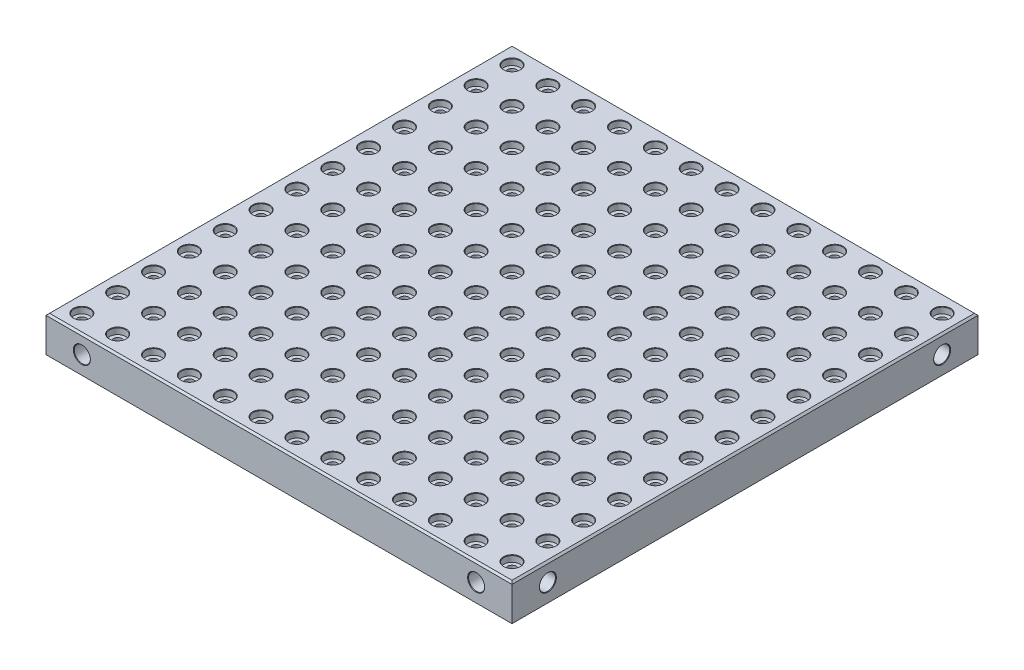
SolidWorks part; units mm, degrees
ref_plane "Plan1" through (0, 0, 0) normal (0, 0, 1) x (1, 0, 0)
ref_plane "Plan2" through (0, 0, 0) normal (0, 1, 0) x (1, 0, 0)
ref_plane "Plan3" through (0, 0, 0) normal (1, 0, 0) x (0, 0, -1)
sketch "Esquisse1" plane through (0, 0, 0) normal (0, 1, 0) x (1, 0, 0)
  line L1 (-260, -260) -> (260, -260)
  line L2 (-260, -260) -> (-260, 260)
  line L3 (-260, 260) -> (260, 260)
  line L4 (260, -260) -> (260, 260)
  dimension "D1" = 520
  dimension "D2" = 520
  dimension "D3" = 260
  dimension "D4" = 260
extrude "Base-Extrusion" add sketch "Esquisse1" along normal blind 40
chamfer "Chanfrein1" distance 2 angle 45 4 edges at (260, 40, 0) (0, 40, -260) (-260, 40, 0) (0, 40, 260)
ref_plane "Plan4" through (0, 40, 0) normal (0, 1, 0) x (-1, 0, 0)
hole_wizard "Perçage1" positions "Esquisse4" profile "Esquisse3" legacy
sketch "Esquisse4" plane through (0, 40, 0) normal (0, 1, 0) x (-1, 0, 0)
  point P0 (-240, 240)
  dimension "L" = 20
sketch "Esquisse3" plane through (240, 40, 240) normal (1, 0, 0) x (0, 0, 1)
  line L0 (0, 0) -> (0, 40)
  line L1 (0, 40) -> (5, 40)
  line L2 (5, 40) -> (5, 7)
  line L3 (5, 7) -> (9, 7)
  line L4 (9, 7) -> (9, 0)
  line L5 (9, 0) -> (0, 0)
  line L6 (0, 110) -> (0, -10) construction
  dimension "Diamètre" = 10
  dimension "Profondeur" = 40
  dimension "Diamètre chambrage" = 18
  dimension "Profondeur chambrage" = 7
chamfer "Chanfrein2" distance 0.5 angle 45 1 edges at (240, 40, 249)
pattern_linear "Répétition linéaire1" count 13 spacing 40 along (-1, 0, 0) count 13 spacing 40 along (0, 0, -1) of "Chanfrein2", "Perçage1"
hole_wizard "Perçage2" positions "Esquisse7" profile "Esquisse6" legacy
sketch "Esquisse7" plane through (260, 0, 0) normal (1, 0, 0) x (0, 0, -1)
  point P0 (-220, 20)
  dimension "D1" = 40
  dimension "D2" = 20
sketch "Esquisse6" plane through (260, 20, 220) normal (0, 1, 0) x (0, 0, -1)
  line L0 (0, 0) -> (0, 40.4077)
  line L1 (0, 40.4077) -> (9, 35)
  line L2 (9, 35) -> (9, 0)
  line L4 (9, 0) -> (0, 0)
  line L6 (0, 40.4077) -> (-9, 35) construction
  line L7 (0, -4.2442) -> (0, 117.3081) construction
  dimension "Diamètre" = 18
  dimension "Profondeur" = 35
  dimension "Angle" = 118
chamfer "Chanfrein3" distance 0.5 angle 45 1 edges at (260, 20, 211)
pattern_linear "Répétition linéaire2" count 2 spacing 440 along (0, 0, -1) of "Perçage2", "Chanfrein3"
mirror "Symétrie1" about plane through (0, 0, 0) normal (1, 0, 0) of "Répétition linéaire2", "Chanfrein3", "Perçage2"
hole_wizard "Perçage4" positions "Esquisse12" profile "Esquisse11" legacy
sketch "Esquisse12" plane through (0, 0, 260) normal (0, 0, 1) x (1, 0, 0)
  point P0 (-220, 20)
  dimension "D1" = 40
  dimension "D2" = 20
sketch "Esquisse11" plane through (-220, 20, 260) normal (1, 0, 0) x (0, -1, 0)
  line L0 (0, 0) -> (0, 40.4077)
  line L1 (0, 40.4077) -> (9, 35)
  line L2 (9, 35) -> (9, 0)
  line L4 (9, 0) -> (0, 0)
  line L6 (0, 40.4077) -> (-9, 35) construction
  line L7 (0, -4.2442) -> (0, 117.3081) construction
  dimension "Diamètre" = 18
  dimension "Profondeur" = 35
  dimension "Angle" = 118
chamfer "Chanfrein4" distance 0.5 angle 45 1 edges at (-211, 20, 260)
pattern_linear "Répétition linéaire3" count 2 spacing 440 along (1, 0, 0) of "Perçage4", "Chanfrein4"
mirror "Symétrie2" about plane through (0, 0, 0) normal (0, 0, 1) of "Perçage4", "Chanfrein4", "Répétition linéaire3"
equation "\"D3@Esquisse1\" = \"D1@Esquisse1\"/2"
equation "\"D2@Esquisse1\" = \"D1@Esquisse1\""
equation "\"D4@Esquisse1\" = \"D3@Esquisse1\""
equation "\"D1@Esquisse7\" = \"L@Esquisse4\"+\"C@Répétition linéaire1\"/2"
equation "\"D2@Esquisse7\" = \"EP@Base-Extrusion\"/2"
equation "\"Diamètre@Esquisse6\" = \"Diamètre chambrage@Esquisse3\""
equation "\"Profondeur@Esquisse6\" = \"C@Répétition linéaire1\"-5"
equation "\"D3@Répétition linéaire2\" = \"D2@Esquisse1\"-\"D1@Esquisse7\"*2"
equation "\"D1@Chanfrein1\" = \"EP@Base-Extrusion\"/20"
equation "\"D2@Esquisse12\" = \"D2@Esquisse7\""
equation "\"D1@Esquisse12\" = \"D1@Esquisse7\""
equation "\"Profondeur@Esquisse11\" = \"Profondeur@Esquisse6\""
equation "\"Diamètre@Esquisse11\" = \"Diamètre@Esquisse6\""
equation "\"D3@Répétition linéaire3\" = \"D3@Répétition linéaire2\""
